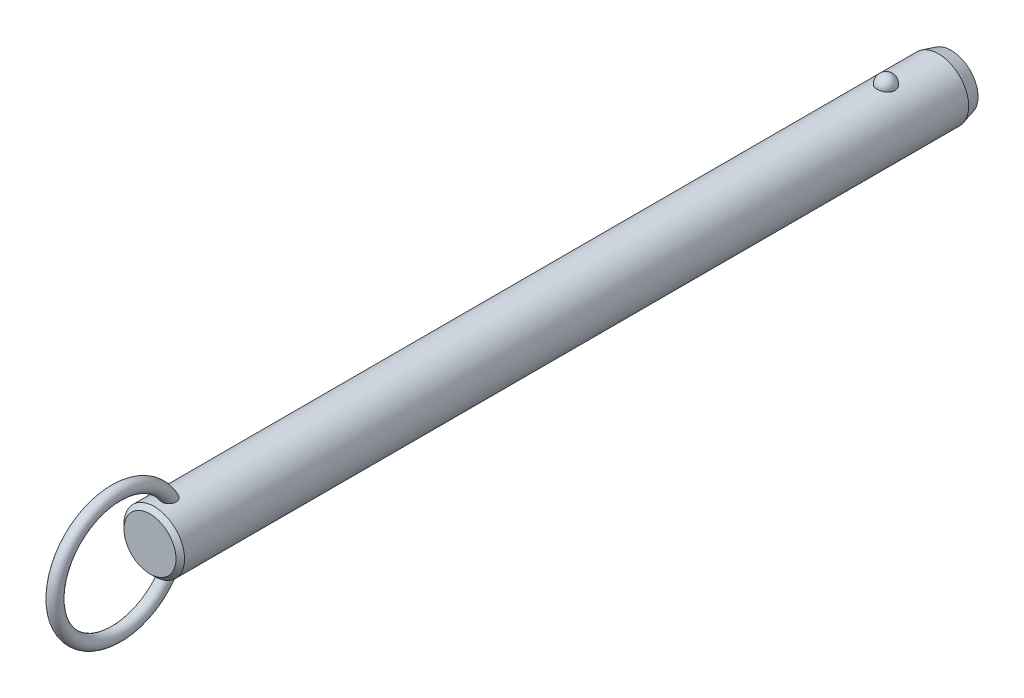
SolidWorks part; units mm, degrees
ref_plane "Front Plane" through (0, 0, 0) normal (0, 0, 1) x (1, 0, 0)
ref_plane "Top Plane" through (0, 0, 0) normal (0, 1, 0) x (1, 0, 0)
ref_plane "Right Plane" through (0, 0, 0) normal (1, 0, 0) x (0, 0, -1)
sketch "Sketch2" plane through (0, 0, 0) normal (0, 0, 1) x (1, 0, 0)
  circle A0 centre (0, 0) radius 7.1
  point P3 (0, 7.1)
  dimension "D1" = 14.2
extrude "Boss-Extrude1" add sketch "Sketch2" along normal blind 162.6
sketch "Sketch3" plane through (0, 0, 0) normal (0, 0, -1) x (-1, 0, 0)
  circle A0 centre (0, 0) radius 7.1
  dimension "D1" = 14.2
extrude "Boss-Extrude2" add sketch "Sketch3" along normal blind 17.4
chamfer "Chamfer1" distance 3 angle 15 1 edges at (-7.1, 0, -17.4)
sketch "Sketch12" plane through (0, 0, 0) normal (1, 0, 0) x (0, 0, -1)
  line L0 (-162.6, 7.1) -> (-162.6, -7.1) construction
  point P0 (-162.6, 0)
sketch "Sketch13" plane through (0, 0, 0) normal (1, 0, 0) x (0, 0, -1)
  circle A0 centre (-178.45, 0) radius 15.85
  point P2 (-162.6, 0)
  dimension "D1" = 31.7
sketch "Sketch14" plane through (0, 0, 0) normal (0, 1, 0) x (1, 0, 0)
  circle A0 centre (0, -164.1) radius 1.5
  point P2 (0, -162.6)
  dimension "D1" = 3
sweep "Sweep1" add profiles "Sketch14" path "Sketch13"
sketch "Sketch15" plane through (0, 0, 162.6) normal (0, 0, 1) x (1, 0, 0)
  circle A0 centre (0, 0) radius 7.1
  dimension "D1" = 14.2
extrude "Boss-Extrude3" add sketch "Sketch15" along normal blind 7.92
chamfer "Chamfer2" distance 1 angle 45 1 edges at (7.1, 0, 170.52)
sketch "Sketch18" plane through (0, 0, 0) normal (1, 0, 0) x (0, 0, -1)
  line L0 (14.4, 7.1) -> (-164.2792, 7.1) construction
  line L1 (2.1, 9.2) -> (2.1, 5)
  line L2 (-164.2792, -7.1) -> (14.4, -7.1) construction
  arc A0 (2.1, 9.2) -> (2.1, 5) centre (2.1, 7.1) ccw
  point P4 (0, 7.1)
  dimension "D1" = 16.3
revolve "Revolve1" add sketch "Sketch18" angle 360 about L1
